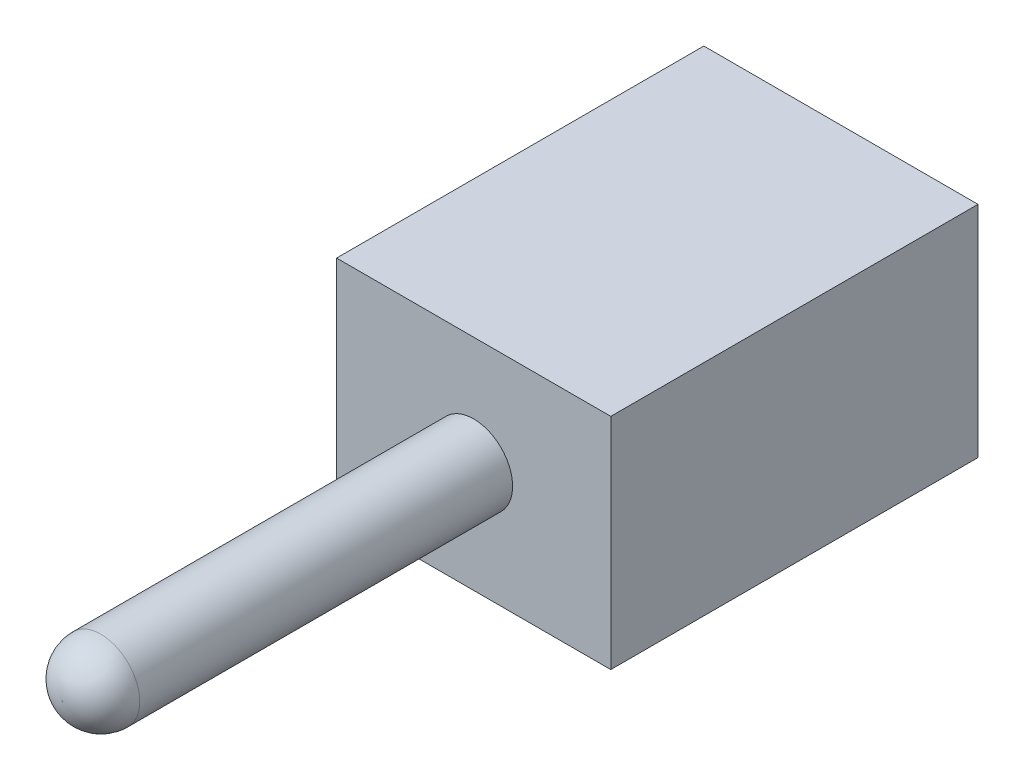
SolidWorks part; units mm, degrees
ref_plane "Front Plane" through (0, 0, 0) normal (0, 0, 1) x (1, 0, 0)
ref_plane "Top Plane" through (0, 0, 0) normal (0, 1, 0) x (1, 0, 0)
ref_plane "Right Plane" through (0, 0, 0) normal (1, 0, 0) x (0, 0, -1)
imported_body "Imported1"
sketch "Sketch1" plane through (0, 0, 0) normal (0, -1, 0) x (1, 0, 0)
  line L4 (-6.35, 17.01) -> (-6.35, 0)
  line L5 (-6.35, 0) -> (6.35, 0)
  line L6 (6.35, 0) -> (6.35, 17.01)
  line L7 (6.35, 17.01) -> (-6.35, 17.01)
  line L8 (-6.35, 17.01) -> (-6.35, 0)
  line L9 (-6.35, 0) -> (6.35, 0)
  line L10 (6.35, 0) -> (6.35, 17.01)
  line L11 (6.35, 17.01) -> (-6.35, 17.01)
  dimension "D1" = 0
extrude "Cut-Extrude1" cut sketch "Sketch1" along normal through all
